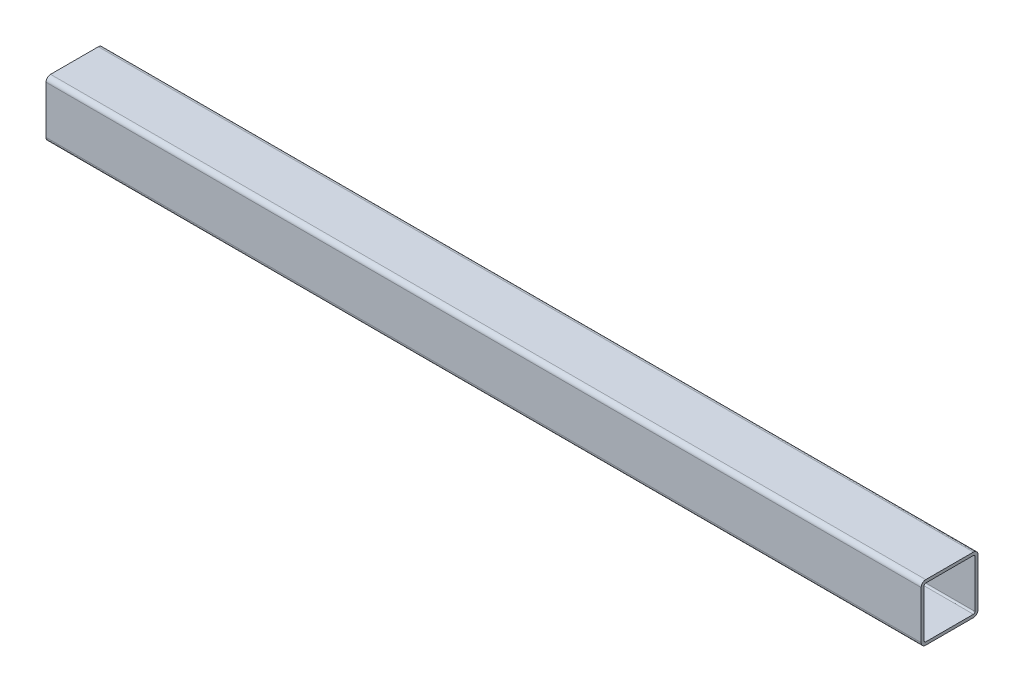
SolidWorks part; units mm, degrees
ref_plane "Front Plane" through (0, 0, 0) normal (0, 0, 1) x (1, 0, 0)
ref_plane "Top Plane" through (0, 0, 0) normal (0, 1, 0) x (1, 0, 0)
ref_plane "Right Plane" through (0, 0, 0) normal (1, 0, 0) x (0, 0, -1)
sketch "Sketch1" plane through (0, 0, 0) normal (1, 0, 0) x (0, 0, -1)
  line L0 (0, 2.54) -> (0, 29.21)
  line L1 (-2.54, 31.75) -> (-29.21, 31.75)
  line L2 (-31.75, 29.21) -> (-31.75, 2.54)
  line L3 (-29.21, 0) -> (-2.54, 0)
  line L4 (-1.651, 2.54) -> (-1.651, 29.21)
  line L5 (-2.54, 30.099) -> (-29.21, 30.099)
  line L6 (-30.099, 29.21) -> (-30.099, 2.54)
  line L7 (-29.21, 1.651) -> (-2.54, 1.651)
  arc A0 (-31.75, 2.54) -> (-29.21, 0) centre (-29.21, 2.54) ccw
  arc A1 (0, 2.54) -> (-2.54, 0) centre (-2.54, 2.54) cw
  arc A2 (0, 29.21) -> (-2.54, 31.75) centre (-2.54, 29.21) ccw
  arc A3 (-31.75, 29.21) -> (-29.21, 31.75) centre (-29.21, 29.21) cw
  arc A4 (-1.651, 29.21) -> (-2.54, 30.099) centre (-2.54, 29.21) ccw
  arc A5 (-30.099, 29.21) -> (-29.21, 30.099) centre (-29.21, 29.21) cw
  arc A6 (-30.099, 2.54) -> (-29.21, 1.651) centre (-29.21, 2.54) ccw
  arc A7 (-1.651, 2.54) -> (-2.54, 1.651) centre (-2.54, 2.54) cw
  point P12 (0, 0)
  point P15 (0, 31.75)
  point P18 (-31.75, 31.75)
  dimension "D3" = 2.54
  dimension "D1" = 31.75
  dimension "D2" = 31.75
  dimension "D4" = 1.651
extrude "Boss-Extrude1" add sketch "Sketch1" along normal blind 488.95
